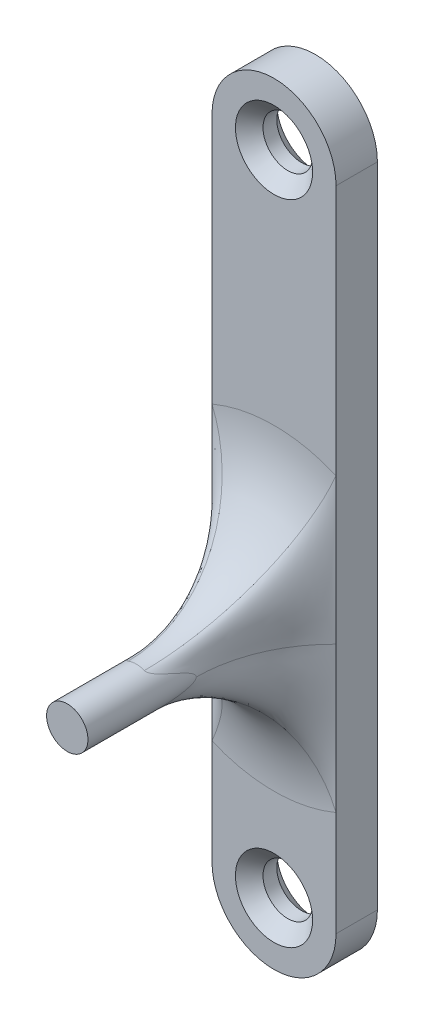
SolidWorks part; units mm, degrees
ref_plane "Front Plane" through (0, 0, 0) normal (0, 0, 1) x (1, 0, 0)
ref_plane "Top Plane" through (0, 0, 0) normal (0, 1, 0) x (1, 0, 0)
ref_plane "Right Plane" through (0, 0, 0) normal (1, 0, 0) x (0, 0, -1)
sketch "Sketch1" plane through (0, 0, 0) normal (0, 0, 1) x (1, 0, 0)
  line L0 (17.3, -23.5) -> (17.3, 23.5)
  line L1 (26.3, -23.5) -> (26.3, 23.5)
  circle A4 centre (21.8, -23.5) radius 1.5 construction
  arc A5 (17.3, -23.5) -> (26.3, -23.5) centre (21.8, -23.5) ccw
  arc A6 (26.3, 23.5) -> (17.3, 23.5) centre (21.8, 23.5) ccw
  circle A7 centre (21.8, 23.5) radius 1.5 construction
  circle A8 centre (21.8, -23.5) radius 1.8
  circle A9 centre (21.8, 23.5) radius 1.8
  dimension "D1" = 0.3
extrude "Boss-Extrude1" add sketch "Sketch1" along normal blind 3
sketch "Sketch2" plane through (0, 0, 3) normal (0, 0, 1) x (1, 0, 0)
  line L0 (26.3, -23.5) -> (26.3, 23.5) construction
  circle A1 centre (21.8, -5.3) radius 1.65 construction
  circle A2 centre (21.8, -5.3) radius 1.5
  dimension "D1" = 3
  dimension "D2" = 3.3
  dimension "D3" = 4.5
  dimension "D4" = 18.2
extrude "Boss-Extrude2" add sketch "Sketch2" along normal blind 15 contours A2
fillet "Fillet1" radius 10 1 edges at (23.3, -5.3, 3)
chamfer "Chamfer1" distance 1 angle 45 4 edges at (23.6, 23.5, 0) (23.6, 23.5, 3) (23.6, -23.5, 0) (23.6, -23.5, 3)
